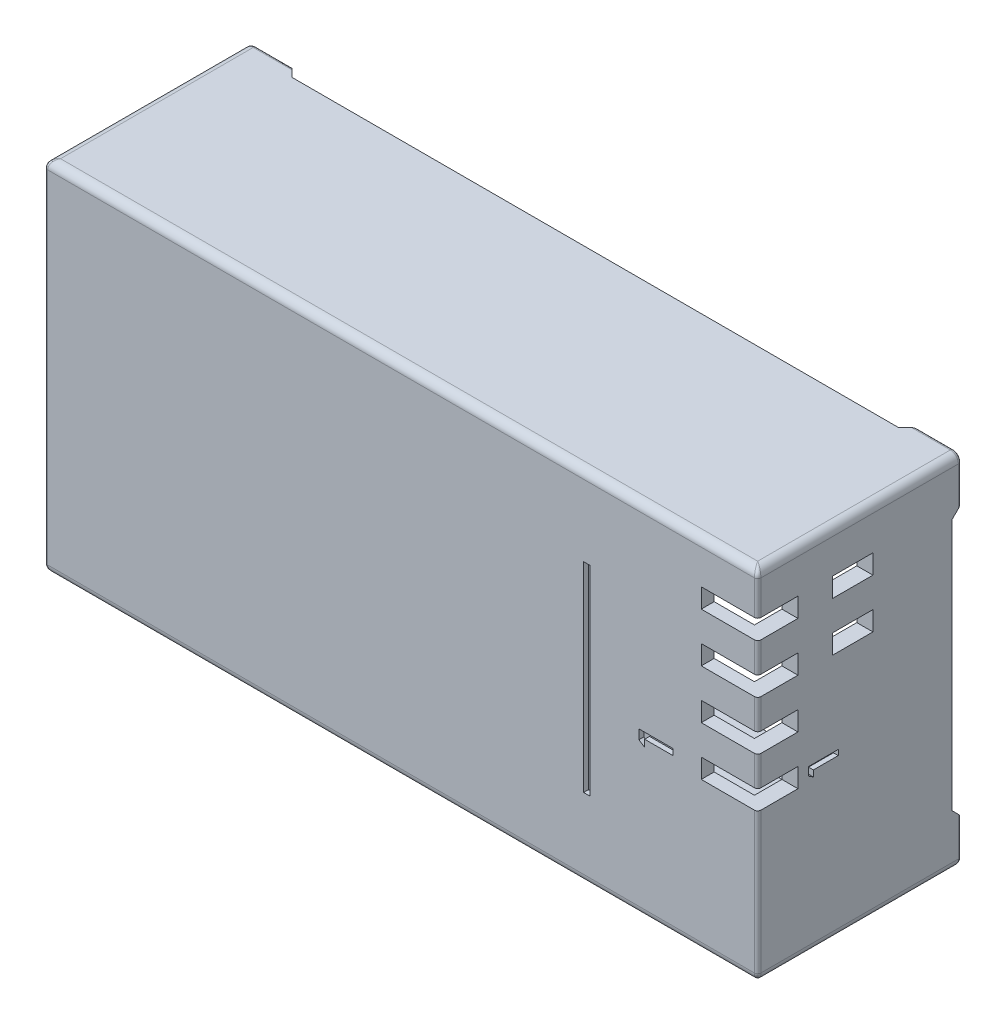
SolidWorks part; units mm, degrees
ref_plane "Front Plane" through (0, 0, 0) normal (0, 0, 1) x (1, 0, 0)
ref_plane "Top Plane" through (0, 0, 0) normal (0, 1, 0) x (1, 0, 0)
ref_plane "Right Plane" through (0, 0, 0) normal (1, 0, 0) x (0, 0, -1)
sketch "Sketch1" plane through (0, 0, 0) normal (0, 0, 1) x (1, 0, 0)
  line L1 (-9.4982, 29.4144) -> (79.0018, 29.4144)
  line L2 (-9.4982, 29.4144) -> (-9.4982, -15.0356)
  line L3 (-9.4982, -15.0356) -> (79.0018, -15.0356)
  line L4 (79.0018, 29.4144) -> (79.0018, -15.0356)
  dimension "D1" = 88.5
  dimension "D2" = 44.45
extrude "Boss-Extrude1" add sketch "Sketch1" along normal blind 1.6
sketch "Sketch2" plane through (0, 0, 0) normal (0, 0, 1) x (1, 0, 0)
  line L1 (79.0018, -15.0356) -> (-9.4982, -15.0356)
  line L2 (79.0018, -15.0356) -> (79.0018, 29.4144)
  line L3 (79.0018, 29.4144) -> (-9.4982, 29.4144)
  line L4 (-9.4982, -15.0356) -> (-9.4982, 29.4144)
extrude "Extrude-Thin1" add sketch "Sketch2" against normal blind 16.2 thin
sketch "Sketch3" plane through (0, 0, 0) normal (0, 0, 1) x (1, 0, 0)
  line L0 (-9.4982, 29.4144) -> (-9.4982, -15.0356) construction
  line L1 (-7.4982, 25.4144) -> (-9.4982, 25.4144)
  line L2 (-7.4982, 25.4144) -> (-7.4982, -3.1856)
  line L3 (-7.4982, -3.1856) -> (-9.4982, -3.1856)
  line L4 (-9.4982, 25.4144) -> (-9.4982, -3.1856)
  line L5 (-9.4982, -15.0356) -> (79.0018, -15.0356) construction
  line L6 (-7.4982, 27.4144) -> (-7.4982, -13.0356) construction
  line L8 (79.0018, 29.4144) -> (-9.4982, 29.4144) construction
  dimension "D1" = 11.85
  dimension "D2" = 4
extrude "Cut-Extrude1" cut sketch "Sketch3" against normal blind 17
ref_plane "Plane2" through (0, 0, -9.2) normal (0, 0, -1) x (-1, 0, 0)
ref_plane "Plane3" through (0, 0, -14.2) normal (0, 0, -1) x (-1, 0, 0)
ref_plane "Plane4" through (0, 0, -16.2) normal (0, 0, -1) x (-1, 0, 0)
sketch "Sketch11" plane through (0, 0, -16.2) normal (0, 0, -1) x (-1, 0, 0)
  line L0 (9.4982, 25.4144) -> (9.4982, 29.4144)
  line L1 (9.4982, 29.4144) -> (-79.0018, 29.4144)
  line L2 (-79.0018, 29.4144) -> (-79.0018, -15.0356)
  line L3 (-79.0018, -15.0356) -> (9.4982, -15.0356)
  line L4 (9.4982, -15.0356) -> (9.4982, -3.1856)
  line L5 (9.4982, -3.1856) -> (7.4982, -3.1856)
  line L6 (7.4982, -3.1856) -> (7.4982, -13.0356)
  line L7 (7.4982, -13.0356) -> (-77.0018, -13.0356)
  line L8 (-77.0018, -13.0356) -> (-77.0018, 27.4144)
  line L9 (-77.0018, 27.4144) -> (7.4982, 27.4144)
  line L10 (7.4982, 27.4144) -> (7.4982, 25.4144)
  line L11 (7.4982, 25.4144) -> (9.4982, 25.4144)
extrude "Boss-Extrude4" add sketch "Sketch11" along normal blind 6.3
ref_plane "Plane5" through (0, 0, -22.5) normal (0, 0, -1) x (-1, 0, 0)
sketch "Sketch13" plane through (0, 0, 0) normal (0, 0, 1) x (1, 0, 0)
  line L1 (-9.4982, -3.1856) -> (0.5018, -3.1856)
  line L2 (-9.4982, -3.1856) -> (-9.4982, 9.2144)
  line L3 (-9.4982, 9.2144) -> (0.5018, 9.2144)
  line L4 (0.5018, -3.1856) -> (0.5018, 9.2144)
  dimension "D1" = 12.4
  dimension "D2" = 10
extrude "Boss-Extrude6" add sketch "Sketch13" against normal blind 1.4
ref_plane "Plane6" through (0, 0, 1.6) normal (0, 0, 1) x (1, 0, 0)
sketch "Sketch15" plane through (0, 0, 1.6) normal (0, 0, 1) x (1, 0, 0)
  line L1 (72.0018, 21.7644) -> (79.0018, 21.7644)
  line L2 (72.0018, 21.7644) -> (72.0018, 24.1644)
  line L3 (72.0018, 24.1644) -> (79.0018, 24.1644)
  line L4 (79.0018, 21.7644) -> (79.0018, 24.1644)
  line L5 (72.0018, 18.0644) -> (79.0018, 18.0644)
  line L6 (72.0018, 18.0644) -> (72.0018, 15.6644)
  line L7 (72.0018, 15.6644) -> (79.0018, 15.6644)
  line L8 (79.0018, 18.0644) -> (79.0018, 15.6644)
  line L9 (72.0018, 9.5644) -> (79.0018, 9.5644)
  line L10 (72.0018, 9.5644) -> (72.0018, 11.9644)
  line L11 (72.0018, 11.9644) -> (79.0018, 11.9644)
  line L12 (79.0018, 9.5644) -> (79.0018, 11.9644)
  line L13 (72.0018, 3.4644) -> (79.0018, 3.4644)
  line L14 (72.0018, 3.4644) -> (72.0018, 5.8644)
  line L15 (72.0018, 5.8644) -> (79.0018, 5.8644)
  line L16 (79.0018, 3.4644) -> (79.0018, 5.8644)
  line L17 (79.0018, 29.4144) -> (79.0018, -15.0356) construction
  line L18 (-9.4982, 29.4144) -> (79.0018, 29.4144) construction
  dimension "D1" = 2.4
  dimension "D2" = 2.4
  dimension "D3" = 2.4
  dimension "D4" = 2.4
  dimension "D5" = 5.25
  dimension "D6" = 3.7
  dimension "D7" = 3.7
  dimension "D8" = 3.7
  dimension "D9" = 7
  dimension "D10" = 7
extrude "Cut-Extrude5" cut sketch "Sketch15" against normal blind 5
ref_plane "Plane7" through (79.0018, 0, 0) normal (1, 0, 0) x (0, 0, -1)
sketch "Sketch16" plane through (79.0018, 0, 0) normal (1, 0, 0) x (0, 0, -1)
  line L0 (-1.6, 24.1644) -> (3.4, 24.1644) construction
  line L1 (12.7, 24.1644) -> (7.7, 24.1644)
  line L2 (12.7, 24.1644) -> (12.7, 21.7644)
  line L3 (12.7, 21.7644) -> (7.7, 21.7644)
  line L4 (7.7, 24.1644) -> (7.7, 21.7644)
  line L5 (12.7, 15.6644) -> (7.7, 15.6644)
  line L6 (12.7, 15.6644) -> (12.7, 18.0644)
  line L7 (12.7, 18.0644) -> (7.7, 18.0644)
  line L8 (7.7, 15.6644) -> (7.7, 18.0644)
  line L9 (3.4, 24.1644) -> (3.4, 21.7644) construction
  dimension "D1" = 5
  dimension "D2" = 5
  dimension "D3" = 2.4
  dimension "D4" = 2.4
  dimension "D5" = 4.3
  dimension "D6" = 3.7
extrude "Cut-Extrude6" cut sketch "Sketch16" against normal blind 3
ref_plane "Plane8" through (0, 0, 0) normal (0, 0, -1) x (-1, 0, 0)
sketch "Sketch17" plane through (0, 0, 0) normal (0, 0, -1) x (-1, 0, 0)
  line L0 (7.4982, -13.0356) -> (-77.0018, -13.0356) construction
  line L1 (-18.5018, -13.0356) -> (-9.1018, -13.0356)
  line L2 (-18.5018, -13.0356) -> (-18.5018, -3.2856)
  line L3 (-18.5018, -3.2856) -> (-9.1018, -3.2856)
  line L4 (-9.1018, -13.0356) -> (-9.1018, -3.2856)
  circle A0 centre (-13.5018, -8.2856) radius 1.7
  point P9 (-18.5018, -8.1606)
  dimension "D1" = 3.4
  dimension "D2" = 5
  dimension "D3" = 4.4
  dimension "D4" = 5
sketch "Sketch19" plane through (0, 0, 0) normal (0, 0, -1) x (-1, 0, 0)
  line L1 (-13.5018, -5.0525) -> (-16.3018, -6.669)
  line L2 (-16.3018, -6.669) -> (-16.3018, -9.9022)
  line L3 (-16.3018, -9.9022) -> (-13.5018, -11.5188)
  line L4 (-13.5018, -11.5188) -> (-10.7018, -9.9022)
  line L5 (-10.7018, -9.9022) -> (-10.7018, -6.669)
  line L6 (-10.7018, -6.669) -> (-13.5018, -5.0525)
  circle A0 centre (-13.5018, -8.2856) radius 2.8 construction
  dimension "D1" = 5.6
ref_plane "Plane9" through (-9.4982, 0, 0) normal (-1, 0, 0) x (0, 0, 1)
sketch "Sketch22" plane through (-9.4982, 0, 0) normal (-1, 0, 0) x (0, 0, 1)
  line L1 (-22.5, -3.1856) -> (-18.1, -3.1856)
  line L2 (-22.5, -3.1856) -> (-22.5, -13.0356)
  line L3 (-22.5, -13.0356) -> (-18.1, -13.0356)
  line L4 (-18.1, -3.1856) -> (-18.1, -13.0356)
  line L5 (-22.5, 25.4144) -> (-18.1, 25.4144)
  line L6 (-22.5, 25.4144) -> (-22.5, 27.4144)
  line L7 (-22.5, 27.4144) -> (-18.1, 27.4144)
  line L8 (-18.1, 25.4144) -> (-18.1, 27.4144)
  line L11 (-22.5, 27.4144) -> (-22.5, 25.4144) construction
  line L12 (-22.5, -3.1856) -> (-22.5, -13.0356) construction
  dimension "D1" = 4.4
extrude "Cut-Extrude8" cut sketch "Sketch22" against normal blind 2.2
sketch "Sketch24" plane through (0, 0, 0) normal (0, 0, -1) x (-1, 0, 0)
  line L0 (-0.5018, -3.1856) -> (-0.5018, 9.2144) construction
  line L1 (1.4982, -1.1856) -> (7.4982, -1.1856)
  line L2 (1.4982, -1.1856) -> (1.4982, 7.2144)
  line L3 (1.4982, 7.2144) -> (7.4982, 7.2144)
  line L4 (7.4982, -1.1856) -> (7.4982, 7.2144)
  line L10 (9.4982, 9.2144) -> (9.4982, -3.1856) construction
  line L11 (-0.5018, 9.2144) -> (9.4982, 9.2144) construction
  line L16 (7.4982, -3.1856) -> (-0.5018, -3.1856) construction
  dimension "D1" = 2
  dimension "D2" = 2
  dimension "D3" = 2
  dimension "D4" = 2
extrude "Cut-Extrude9" cut sketch "Sketch24" along normal blind 3
sketch "Sketch26" plane through (0, 0, -22.5) normal (0, 0, -1) x (-1, 0, 0)
  line L0 (-77.0018, -13.0356) -> (-77.0018, 27.4144) construction
  line L1 (9.4982, -13.0356) -> (-77.0018, -13.0356)
  line L2 (9.4982, -13.0356) -> (9.4982, -11.4356)
  line L3 (9.4982, -11.4356) -> (-77.0018, -11.4356)
  line L4 (-77.0018, -13.0356) -> (-77.0018, -11.4356)
  line L6 (9.4982, 27.4144) -> (9.4982, 29.4144) construction
  line L7 (-77.0018, 27.4144) -> (9.4982, 27.4144)
  line L8 (-77.0018, 27.4144) -> (-77.0018, 25.8144)
  line L9 (-77.0018, 25.8144) -> (9.4982, 25.8144)
  line L10 (9.4982, 27.4144) -> (9.4982, 25.8144)
  dimension "D1" = 1.6
  dimension "D2" = 1.6
extrude "Boss-Extrude10" add sketch "Sketch26" against normal blind 1.9
sketch "Sketch27" plane through (-9.4982, 0, 0) normal (-1, 0, 0) x (0, 0, 1)
  line L1 (-18.1, -13.0356) -> (-18.1, -3.1856) construction
  line L3 (-18.1, -3.1856) -> (-1.4, -3.1856) construction
  line L5 (-8.4027, -8.1856) -> (-10.0771, -5.2856)
  line L6 (-10.0771, -5.2856) -> (-13.4257, -5.2856)
  line L7 (-13.4257, -5.2856) -> (-15.1, -8.1856)
  line L8 (-15.1, -8.1856) -> (-13.4257, -11.0856)
  line L9 (-13.4257, -11.0856) -> (-10.0771, -11.0856)
  line L10 (-10.0771, -11.0856) -> (-8.4027, -8.1856)
  circle A0 centre (-11.7514, -8.1856) radius 2.9 construction
  dimension "D1" = 5
  dimension "D2" = 5.8
  dimension "D3" = 3
sketch "Sketch32" plane through (-9.4982, 0, 0) normal (-1, 0, 0) x (0, 0, 1)
  line L0 (-22.5, 25.8144) -> (-22.5, 29.4144) construction
  line L1 (-20.6, -13.0356) -> (-22.5, -13.0356)
  line L2 (-20.6, -13.0356) -> (-20.6, -11.4356)
  line L3 (-20.6, -11.4356) -> (-22.5, -11.4356)
  line L4 (-22.5, -13.0356) -> (-22.5, -11.4356)
  line L5 (-20.6, 25.8144) -> (-22.5, 25.8144)
  line L6 (-20.6, 25.8144) -> (-20.6, 27.4144)
  line L7 (-20.6, 27.4144) -> (-22.5, 27.4144)
  line L8 (-22.5, 25.8144) -> (-22.5, 27.4144)
  line L9 (1.6, 29.4144) -> (-22.5, 29.4144) construction
  line L14 (1.6, -15.0356) -> (-22.5, -15.0356) construction
  line L15 (-20.6, -11.4356) -> (-20.6, -13.0356) construction
  dimension "D2" = 2
  dimension "D3" = 2
extrude "Cut-Extrude12" cut sketch "Sketch32" against normal blind 3.4
sketch "Sketch34" plane through (0, 0, 1.6) normal (0, 0, 1) x (1, 0, 0)
  line L1 (-12.1998, 34.9422) -> (11.6668, 34.9422)
  line L2 (-12.1998, 34.9422) -> (-12.1998, -25.9177)
  line L3 (-12.1998, -25.9177) -> (11.6668, -25.9177)
  line L4 (11.6668, 34.9422) -> (11.6668, -25.9177)
sketch "Sketch37" plane through (79.0018, 0, 0) normal (1, 0, 0) x (0, 0, -1)
  line L1 (22.2863, 32.2392) -> (-6.7125, 32.2392)
  line L2 (22.2863, 32.2392) -> (22.2863, -18.4051)
  line L3 (22.2863, -18.4051) -> (-6.7125, -18.4051)
  line L4 (-6.7125, 32.2392) -> (-6.7125, -18.4051)
ref_plane "Plane13" through (77.0018, 0, 0) normal (-1, 0, 0) x (0, 0, 1)
sketch "Sketch39" plane through (77.0018, 0, 0) normal (-1, 0, 0) x (0, 0, 1)
  line L3 (-22.5, 25.8144) -> (-12.5, 25.8144)
  line L4 (-22.5, 25.8144) -> (-22.5, 27.3144)
  line L5 (-22.5, 27.3144) -> (-12.5, 27.3144)
  line L6 (-12.5, 25.8144) -> (-12.5, 27.3144)
  line L7 (-22.5, -11.4356) -> (-12.5, -11.4356)
  line L8 (-22.5, -11.4356) -> (-22.5, -12.9356)
  line L9 (-22.5, -12.9356) -> (-12.5, -12.9356)
  line L10 (-12.5, -11.4356) -> (-12.5, -12.9356)
  dimension "D1" = 1.5
  dimension "D2" = 1.5
  dimension "D3" = 10
  dimension "D4" = 10
extrude "Cut-Extrude16" cut sketch "Sketch39" along normal blind 6.5
sketch "Sketch40" plane through (0, 0, 1.6) normal (0, 0, 1) x (1, 0, 0)
  line L0 (68.5018, 24.4144) -> (68.5018, 2.9144) construction
  line L1 (79.0018, 29.4144) -> (-9.4982, 29.4144) construction
  line L4 (72.0018, 24.1644) -> (72.0018, 21.7644) construction
  text T0 "1" font "Century Gothic" height in points 16
  point P10 (72.0018, 22.9644)
  dimension "D1" = 5
  dimension "D2" = 3.5
  dimension "D3" = 21.5
extrude "Cut-Extrude17" cut sketch "Sketch40" against normal blind 0.6
sketch "Sketch41" plane through (0, 0, 1.6) normal (0, 0, 1) x (1, 0, 0)
  line L1 (79.0018, 29.4144) -> (-9.4982, 29.4144) construction
  line L2 (5.5018, 22.2144) -> (5.5018, -7.7856) construction
  line L4 (13.5018, 17.4144) -> (13.5018, -2.5856) construction
  line L7 (-9.4982, 29.4144) -> (-9.4982, -15.0356) construction
  text T1 "VASalg" font "Arial" height in points 20
  text T2 "fxo4" font "Century Gothic" height in points 18
  dimension "D3" = 23
  dimension "D4" = 8
  dimension "D5" = 30
  dimension "D6" = 20
  dimension "D7" = 4.8
  dimension "D8" = 7.2
sketch "Sketch43" plane through (0, 0, -22.5) normal (0, 0, -1) x (-1, 0, 0)
  line L0 (-79.0018, -15.0356) -> (9.4982, -15.0356) construction
  line L1 (9.4982, 29.4144) -> (4.4982, 29.4144)
  line L2 (9.4982, 29.4144) -> (9.4982, 27.4144)
  line L3 (9.4982, 27.4144) -> (4.4982, 27.4144)
  line L4 (4.4982, 29.4144) -> (4.4982, 27.4144)
  line L5 (9.4982, -13.0356) -> (4.4982, -13.0356)
  line L6 (9.4982, -13.0356) -> (9.4982, -15.0356)
  line L7 (9.4982, -15.0356) -> (4.4982, -15.0356)
  line L8 (4.4982, -13.0356) -> (4.4982, -15.0356)
  line L9 (-74.0018, -12.9356) -> (-74.0018, -15.0356)
  line L10 (-70.5018, -12.9356) -> (-77.0018, -12.9356) construction
  line L11 (-74.0018, -15.0356) -> (-79.0018, -15.0356)
  line L12 (-79.0018, -15.0356) -> (-79.0018, -10.0356)
  line L13 (-79.0018, 29.4144) -> (-79.0018, -15.0356) construction
  line L14 (-79.0018, -10.0356) -> (-77.0018, -10.0356)
  line L15 (-77.0018, -12.9356) -> (-77.0018, 27.3144) construction
  line L16 (-77.0018, -10.0356) -> (-77.0018, -12.9356)
  line L17 (-77.0018, -12.9356) -> (-74.0018, -12.9356)
  line L18 (-77.0018, 27.3144) -> (-77.0018, 24.4144)
  line L19 (-79.0018, 29.4144) -> (-74.0018, 29.4144)
  line L20 (-79.0018, 29.4144) -> (-79.0018, 24.4144)
  line L21 (-77.0018, 24.4144) -> (-79.0018, 24.4144)
  line L22 (-74.0018, 29.4144) -> (-74.0018, 27.3144)
  line L23 (-77.0018, 27.3144) -> (-74.0018, 27.3144)
  line L24 (-70.5018, 27.3144) -> (-77.0018, 27.3144) construction
  dimension "D1" = 5
  dimension "D2" = 5
  dimension "D3" = 5
  dimension "D4" = 5
  dimension "D5" = 5
  dimension "D6" = 5
  dimension "D7" = 2
extrude "Boss-Extrude14" add sketch "Sketch43" along normal blind 1.2
chamfer "Chamfer2" distance 1.6 angle 45 24 edges at (-4.4982, 28.4144, -22.5) (-4.4982, 29.4144, -23.1) (-4.4982, 27.4144, -23.1) (-4.4982, 28.4144, -23.7) (-4.4982, -14.0356, -22.5) (-4.4982, -13.0356, -23.1) (-4.4982, -15.0356, -23.1) (-4.4982, -14.0356, -23.7) (74.0018, -12.9356, -23.1) (78.0018, -10.0356, -22.5) (77.0018, -10.0356, -23.1) (79.0018, -10.0356, -23.1) (74.0018, -13.9856, -22.5) (74.0018, -15.0356, -23.1) (78.0018, -10.0356, -23.7) (74.0018, -13.9856, -23.7) (78.0018, 24.4144, -22.5) (79.0018, 24.4144, -23.1) (77.0018, 24.4144, -23.1) (74.0018, 28.3644, -22.5) (74.0018, 27.3144, -23.1) (74.0018, 29.4144, -23.1) (78.0018, 24.4144, -23.7) (74.0018, 28.3644, -23.7)
fillet "Fillet5" radius 1 6 edges at (-9.4982, -15.0356, -11.05) (-9.4982, 29.4144, -11.05) (34.7518, 29.4144, 1.6) (79.0018, 29.4144, -11.05) (34.7518, -15.0356, 1.6) (79.0018, -15.0356, -11.05)
sketch "Sketch44" plane through (0, 0, 1.6) normal (0, 0, 1) x (1, 0, 0)
  line L0 (79.0018, -14.0356) -> (79.0018, 3.4644) construction
  line L3 (-9.4982, -14.0356) -> (79.0018, -14.0356) construction
  line L4 (58.2018, -5.2356) -> (57.4018, -5.2356)
  line L10 (58.2018, -5.2356) -> (58.2018, 19.5644)
  line L11 (58.2018, 19.5644) -> (57.4018, 19.5644)
  line L12 (57.4018, -5.2356) -> (57.4018, 19.5644)
  dimension "D1" = 0.8
  dimension "D2" = 24.8
  dimension "D3" = 8.8
  dimension "D4" = 20.8
ref_plane "Plane14" through (0, 0, 0) normal (0, 0, -1) x (-1, 0, 0)
fillet "Fillet6" radius 0.4 24 edges at (-9.4982, 27.9144, -23.7) (-9.2053, 29.1215, -23.7) (-9.4982, -13.5356, -23.7) (-9.2053, -14.7427, -23.7) (75.8018, 29.4144, -23.7) (78.7089, 29.1215, -23.7) (79.0018, -11.8356, -23.7) (78.7089, -14.7427, -23.7) (-4.0982, 28.4144, -23.7) (-6.2982, 29.4144, -23.7) (-6.7982, 27.4144, -23.7) (-4.0982, -14.0356, -23.7) (-6.7982, -13.0356, -23.7) (-6.2982, -15.0356, -23.7) (75.3018, 27.3144, -23.7) (73.6018, 28.3644, -23.7) (77.0018, 25.6644, -23.7) (79.0018, 26.2144, -23.7) (78.0018, 24.0144, -23.7) (77.0018, -11.2856, -23.7) (75.3018, -12.9356, -23.7) (75.8018, -15.0356, -23.7) (78.0018, -9.6356, -23.7) (73.6018, -13.9856, -23.7)
ref_plane "Plane15" through (-6.0982, 0, 0) normal (-1, 0, 0) x (0, 0, 1)
sketch "Sketch46" plane through (-6.0982, 0, 0) normal (-1, 0, 0) x (0, 0, 1)
  line L0 (-20.6, -11.4356) -> (-22.5, -11.4356) construction
  line L1 (-20.6, -13.0356) -> (-20.75, -13.0356)
  line L2 (-20.6, -13.0356) -> (-20.6, -11.4356)
  line L3 (-20.6, -11.4356) -> (-20.75, -11.4356)
  line L4 (-20.75, -13.0356) -> (-20.75, -11.4356)
  line L5 (-18.1, 27.4144) -> (-23.3, 27.4144) construction
  line L6 (-20.6, 25.8144) -> (-20.75, 25.8144)
  line L7 (-20.6, 25.8144) -> (-20.6, 27.4144)
  line L8 (-20.6, 27.4144) -> (-20.75, 27.4144)
  line L9 (-20.75, 25.8144) -> (-20.75, 27.4144)
  dimension "D1" = 0.15
  dimension "D2" = 0.15
extrude "Cut-Extrude20" cut sketch "Sketch46" against normal up to surface (83.1 mm away)
extrude "Cut-Extrude21" cut sketch "Sketch44" against normal blind 0.6
ref_plane "Plane16" through (0, 0, -18.1) normal (0, 0, -1) x (-1, 0, 0)
sketch "Sketch50" plane through (0, 0, -18.1) normal (0, 0, -1) x (-1, 0, 0)
  line L1 (9.4982, -3.1856) -> (7.4982, -3.1856)
  line L2 (9.4982, -3.1856) -> (9.4982, -13.0356)
  line L3 (9.4982, -13.0356) -> (7.4982, -13.0356)
  line L4 (7.4982, -3.1856) -> (7.4982, -13.0356)
extrude "Cut-Extrude24" cut sketch "Sketch50" against normal blind 6
ref_plane "Plane17" through (0, 0, -12.1) normal (0, 0, -1) x (-1, 0, 0)
sketch "Sketch51" plane through (0, 0, -12.1) normal (0, 0, -1) x (-1, 0, 0)
  line L0 (7.4982, -13.0356) -> (9.4982, -13.0356) construction
  line L1 (7.4982, -3.1856) -> (1.8982, -3.1856)
  line L2 (7.4982, -3.1856) -> (7.4982, -13.0356)
  line L3 (7.4982, -13.0356) -> (1.8982, -13.0356)
  line L4 (1.8982, -3.1856) -> (1.8982, -13.0356)
  line L5 (7.4982, -3.1856) -> (7.4982, -13.0356) construction
  dimension "D1" = 5.6
extrude "Boss-Extrude15" add sketch "Sketch51" against normal up to surface (12.1 mm away)
sketch "Sketch52" plane through (-9.4982, 0, 0) normal (-1, 0, 0) x (0, 0, 1)
  line L1 (-12.1, -3.1856) -> (-1.4, -3.1856)
  line L2 (-12.1, -3.1856) -> (-12.1, -13.0356)
  line L3 (-12.1, -13.0356) -> (-1.4, -13.0356)
  line L4 (-1.4, -3.1856) -> (-1.4, -13.0356)
extrude "Cut-Extrude25" cut sketch "Sketch52" against normal blind 3.4
ref_plane "Plane18" through (-1.8982, 0, 0) normal (1, 0, 0) x (0, 0, -1)
sketch "Sketch53" plane through (-1.8982, 0, 0) normal (1, 0, 0) x (0, 0, -1)
  line L0 (1.4, -3.1856) -> (12.1, -3.1856) construction
  line L1 (10.1, -8.0106) -> (8.469, -5.1856)
  line L2 (8.469, -5.1856) -> (5.207, -5.1856)
  line L3 (5.207, -5.1856) -> (3.5759, -8.0106)
  line L4 (3.5759, -8.0106) -> (5.207, -10.8356)
  line L5 (5.207, -10.8356) -> (8.469, -10.8356)
  line L6 (8.469, -10.8356) -> (10.1, -8.0106)
  line L7 (12.1, -3.1856) -> (12.1, -13.0356) construction
  circle A0 centre (6.838, -8.0106) radius 2.825 construction
  dimension "D1" = 5.65
  dimension "D2" = 2
  dimension "D3" = 2
extrude "Cut-Extrude26" cut sketch "Sketch53" against normal blind 2.6
sketch "Sketch54" plane through (-1.8982, 0, 0) normal (1, 0, 0) x (0, 0, -1)
  circle A0 centre (6.838, -8.0106) radius 1.7
  dimension "D1" = 3.4
extrude "Cut-Extrude27" cut sketch "Sketch54" against normal up to surface (4.2 mm away)
sketch "Sketch56" plane through (0, 0, -18.1) normal (0, 0, -1) x (-1, 0, 0)
  line L0 (2.8982, 27.4144) -> (6.0982, 27.4144) construction
  line L1 (6.0982, -11.2356) -> (-70.5018, -11.2356)
  line L2 (6.0982, -11.2356) -> (6.0982, -13.0356)
  line L3 (6.0982, -13.0356) -> (-70.5018, -13.0356)
  line L4 (-70.5018, -11.2356) -> (-70.5018, -13.0356)
  line L5 (7.4982, 27.4144) -> (-70.5018, 27.4144)
  line L6 (7.4982, 27.4144) -> (7.4982, 25.4144)
  line L7 (7.4982, 25.4144) -> (-70.5018, 25.4144)
  line L8 (-70.5018, 27.4144) -> (-70.5018, 25.4144)
  line L9 (2.8982, -13.0356) -> (6.0982, -13.0356) construction
  line L10 (6.0982, -3.1856) -> (6.0982, -13.0356) construction
  line L11 (-70.5018, -11.4356) -> (-70.5018, -12.9356) construction
  line L12 (7.4982, 25.4144) -> (7.4982, 27.4144) construction
  line L15 (7.4982, 25.4144) -> (9.4982, 25.4144) construction
  dimension "D1" = 1.8
extrude "Boss-Extrude16" add sketch "Sketch56" against normal up to surface (6 mm away)
chamfer "Chamfer3" distance 1.8 angle 60 2 edges at (31.5018, 27.4144, -12.1) (34.3018, -13.0356, -12.1)
ref_plane "Plane19" through (0, 0, -18.1) normal (0, 0, -1) x (-1, 0, 0)
sketch "Sketch57" plane through (0, 0, -18.1) normal (0, 0, -1) x (-1, 0, 0)
  line L0 (9.4982, 28.4144) -> (9.4982, 27.4144) construction
  line L1 (9.4982, 25.4144) -> (6.0982, 25.4144)
  line L2 (9.4982, 25.4144) -> (9.4982, 27.4144)
  line L3 (9.4982, 27.4144) -> (6.0982, 27.4144)
  line L4 (6.0982, 25.4144) -> (6.0982, 27.4144)
  dimension "D1" = 3.4
  dimension "D2" = 2
extrude "Cut-Extrude28" cut sketch "Sketch57" against normal blind 5.4
fillet "Fillet7" radius 0.4 10 edges at (-9.2053, 29.1215, 1.3071) (-9.2053, -14.7427, 1.3071) (78.7089, 29.1215, 1.3071) (78.7089, -14.7427, 1.3071) (-9.4982, 7.1894, 1.6) (79.0018, 26.2894, 1.6) (79.0018, 19.9144, 1.6) (79.0018, 13.8144, 1.6) (79.0018, 7.7144, 1.6) (79.0018, -5.2856, 1.6)
ref_plane "Plane20" through (0, 0, 0) normal (0, 0, -1) x (-1, 0, 0)
sketch "Sketch58" plane through (0, 0, 0) normal (0, 0, -1) x (-1, 0, 0)
  line L0 (-7.3382, 1.3582) -> (-7.3382, 12.6975) construction
  text T0 "V1.1  " font "Century Gothic" height in points 14
extrude "Cut-Extrude29" cut sketch "Sketch58" against normal blind 0.8
sketch "Sketch59" plane through (0, 0, 0) normal (0, 0, 1) x (1, 0, 0)
  line L1 (11.5018, 9.9644) -> (13.5018, 9.9644)
  line L2 (11.5018, 9.9644) -> (11.5018, 4.9644)
  line L3 (11.5018, 4.9644) -> (13.5018, 4.9644)
  line L4 (13.5018, 9.9644) -> (13.5018, 4.9644)
  line L5 (72.4018, -15.0356) -> (-2.8982, -15.0356) construction
  line L6 (-9.4982, 25.4144) -> (-9.4982, 9.2144) construction
  dimension "D1" = 21
  dimension "D2" = 5
  dimension "D3" = 2
  dimension "D4" = 20
extrude "Boss-Extrude17" add sketch "Sketch59" against normal blind 3
fillet "Fillet8" radius 1 4 edges at (12.5018, 4.9644, 0) (13.5018, 7.4644, 0) (12.5018, 9.9644, 0) (11.5018, 7.4644, 0)
ref_plane "Plane21" through (0, 0, -22.5) normal (0, 0, -1) x (-1, 0, 0)
sketch "Sketch60" plane through (0, 0, -22.5) normal (0, 0, -1) x (-1, 0, 0)
  line L0 (-70.5018, 25.4144) -> (6.0982, 25.4144) construction
  line L1 (-70.5018, 27.3144) -> (-69.0018, 27.3144)
  line L2 (-70.5018, 27.3144) -> (-70.5018, 25.4144)
  line L3 (-70.5018, 25.4144) -> (-69.0018, 25.4144)
  line L4 (-69.0018, 27.3144) -> (-69.0018, 25.4144)
  dimension "D1" = 1.5
extrude "Cut-Extrude30" cut sketch "Sketch60" against normal up to surface (22.5 mm away)
ref_plane "Plane22" through (79.0018, 0, 0) normal (1, 0, 0) x (0, 0, -1)
sketch "Sketch62" plane through (79.0018, 0, 0) normal (1, 0, 0) x (0, 0, -1)
  line L0 (8.4, 2.7644) -> (8.4, 6.7644) construction
  line L1 (-1.2, -14.0356) -> (23.3, -14.0356) construction
  line L2 (-1.6, -14.0356) -> (-1.6, 3.4644) construction
  text T0 "1" font "Century Gothic" height in points 14
  dimension "D1" = 16.8
  dimension "D2" = 4
  dimension "D3" = 10
extrude "Cut-Extrude31" cut sketch "Sketch62" against normal blind 0.6
ref_plane "Plane23" through (0, 27.3144, 0) normal (0, -1, 0) x (-1, 0, 0)
sketch "Sketch63" plane through (0, 27.3144, 0) normal (0, -1, 0) x (-1, 0, 0)
  line L1 (-70.5018, 18.1) -> (-69.0018, 18.1)
  line L2 (-70.5018, 18.1) -> (-70.5018, 8.558)
  line L3 (-70.5018, 8.558) -> (-69.0018, 8.558)
  line L4 (-69.0018, 18.1) -> (-69.0018, 8.558)
extrude "Cut-Extrude32" cut sketch "Sketch63" against normal up to surface (0.1 mm away)
